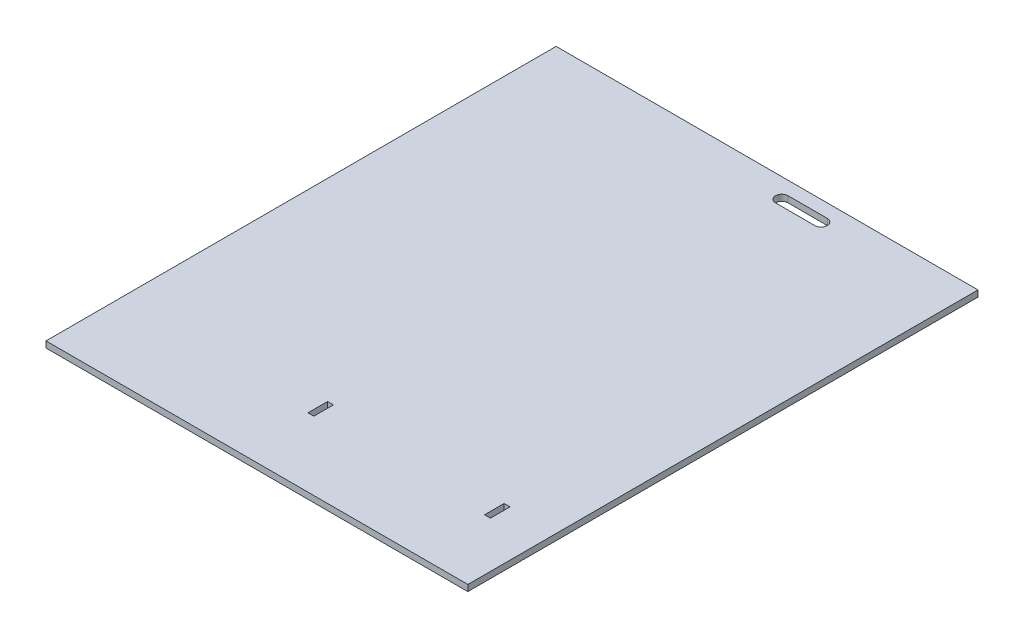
SolidWorks part; units mm, degrees
ref_plane "Front Plane" through (0, 0, 0) normal (0, 0, 1) x (1, 0, 0)
ref_plane "Top Plane" through (0, 0, 0) normal (0, 1, 0) x (1, 0, 0)
ref_plane "Right Plane" through (0, 0, 0) normal (1, 0, 0) x (0, 0, -1)
sketch "Sketch1" plane through (0, 0, 0) normal (0, 1, 0) x (1, 0, 0)
  line L0 (-20, 151.9235) -> (0, 151.9235) construction
  line L1 (-145, -98.0765) -> (70, -98.0765)
  line L2 (-145, -98.0765) -> (-145, -50)
  line L3 (-145, 161.9235) -> (-43.5014, 161.9235)
  line L4 (70, -98.0765) -> (70, -50)
  line L6 (-70, 0) -> (70, 0) construction
  line L7 (-46.4986, -53.0765) -> (-43.5014, -53.0765)
  line L8 (-46.4986, -53.0765) -> (-46.4986, -63.0765)
  line L9 (-46.4986, -63.0765) -> (-43.5014, -63.0765)
  line L10 (-43.5014, -53.0765) -> (-43.5014, -63.0765)
  line L11 (-45, -63.0765) -> (-45, -53.0765) construction
  line L12 (-46.4986, -58.0765) -> (-43.5014, -58.0765) construction
  line L13 (43.5014, -53.0765) -> (46.4986, -53.0765)
  line L14 (43.5014, -53.0765) -> (43.5014, -63.0765)
  line L15 (43.5014, -63.0765) -> (46.4986, -63.0765)
  line L16 (46.4986, -53.0765) -> (46.4986, -63.0765)
  line L17 (45, -63.0765) -> (45, -53.0765) construction
  line L18 (43.5014, -58.0765) -> (46.4986, -58.0765) construction
  line L19 (-20, 155.0985) -> (0, 155.0985)
  line L20 (-20, 148.7485) -> (0, 148.7485)
  line L25 (-145, -50) -> (-145, 161.9235)
  line L26 (70, -50) -> (70, 161.9235)
  line L27 (23.5, 161.9235) -> (70, 161.9235)
  line L28 (-43.5014, 161.9235) -> (23.5, 161.9235)
  circle A0 centre (-10, 151.9235) radius 3.175 construction
  arc A1 (-20, 155.0985) -> (-20, 148.7485) centre (-20, 151.9235) ccw
  arc A2 (0, 148.7485) -> (0, 155.0985) centre (0, 151.9235) ccw
  point P0 (0, 0)
  point P16 (-10, 151.9235)
  point P21 (0, 0)
  point P22 (0, 0)
  point P23 (-10.0007, 151.9235)
  point P24 (0, 0)
  point P25 (0, 0)
  point P26 (0, 0)
  point P27 (0, 0)
  point P30 (0, 0)
  point P168 (45, -58.0765)
  point P180 (-45, -58.0765)
  dimension "D12" = 6.35
  dimension "D1" = 2.9972
  dimension "D2" = 10
  dimension "D3" = 40
  dimension "D4" = 10
  dimension "D5" = 2.9972
  dimension "D6" = 40
  dimension "D7" = 80
  dimension "D9" = 215
  dimension "D10" = 260
  dimension "D13" = 6.35
  dimension "D15" = 250
extrude "Boss-Extrude1" add sketch "Sketch1" along normal blind 3.175
